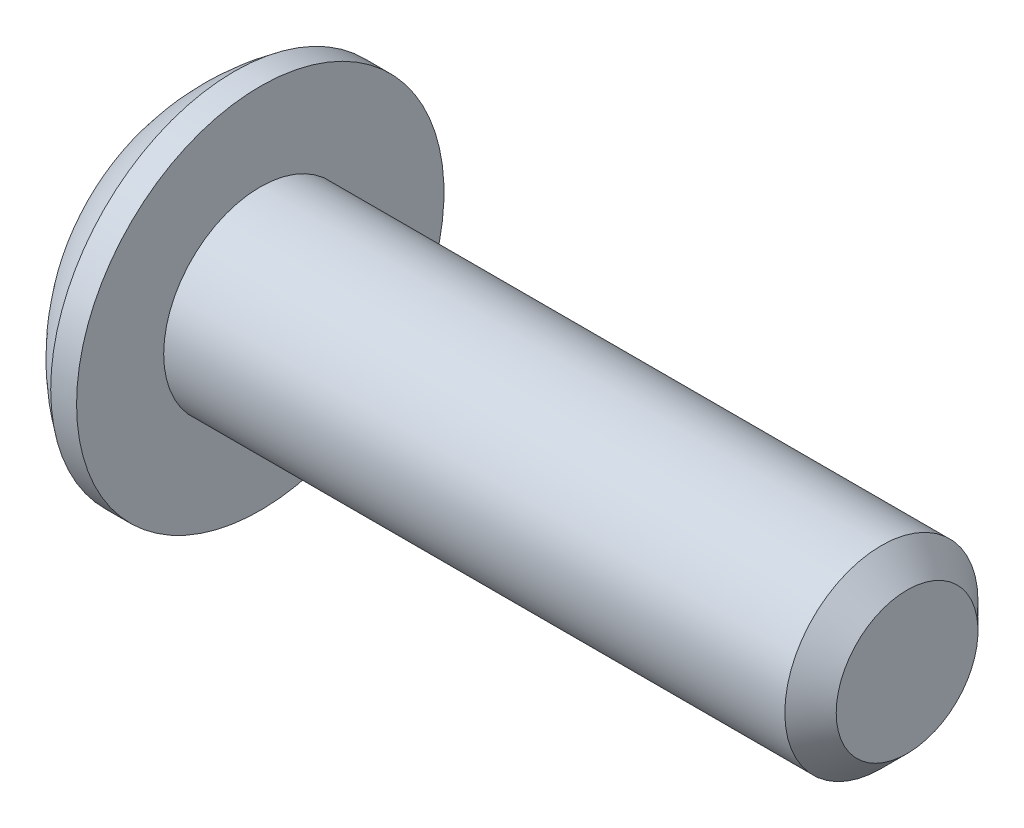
SolidWorks part; units mm, degrees
ref_plane "Plane1" through (0, 0, 0) normal (0, 0, 1) x (1, 0, 0)
ref_plane "Plane2" through (0, 0, 0) normal (0, 1, 0) x (1, 0, 0)
ref_plane "Plane3" through (0, 0, 0) normal (1, 0, 0) x (0, 0, -1)
sketch "BodySke" plane through (0, 0, 0) normal (0, 0, 1) x (1, 0, 0)
  line L0 (11.0236, 0) -> (11.0236, 1.0439)
  line L1 (10.6451, 1.4224) -> (1.4986, 1.4224)
  line L2 (1.4986, 1.4224) -> (1.4986, 2.7051)
  line L3 (1.4986, 2.7051) -> (1.1176, 2.7051)
  line L4 (0, 0) -> (101.6, 0) construction
  line L5 (1.4986, -2.7051) -> (1.1176, -2.7051) construction
  line L6 (55.6768, -1.4224) -> (1.4986, -1.4224) construction
  line L7 (11.0236, 0) -> (0, 0)
  line L8 (0, 1.3526) -> (0, -1.3526) construction
  line L9 (0, 0) -> (0, 1.3526)
  line L10 (11.0236, 1.0439) -> (10.6451, 1.4224)
  line L11 (11.0236, -1.0439) -> (10.6451, -1.4224) construction
  line L12 (2.1336, 9.525) -> (2.1336, -1.4224) construction
  line L13 (7.8486, 9.525) -> (7.8486, -1.4224) construction
  arc A1 (0, 1.3526) -> (1.1176, 2.7051) centre (3.0141, 0) cw
  dimension "D1" = 2.7051
  dimension "Diameter" = 2.8448
  dimension "Length" = 9.525
  dimension "Head_dia" = 5.4102
  dimension "Head_ht" = 1.4986
  dimension "Head_side_ht" = 0.381
  dimension "Minor_dia" = 2.0879
  dimension "Body_ch_ang" = 45
  dimension "Advance" = 0.635
  dimension "Thread_nom" = 3.175
revolve "BaseBody" add sketch "BodySke" angle 360 about L4
sketch "Sketch2" plane through (0, 0, 0) normal (0, 0, 1) x (1, 0, 0)
  line L0 (0, 0.7874) -> (0.889, 0.7874)
  line L1 (0.889, 0.7874) -> (1.3436, 0)
  line L3 (1.3436, 0) -> (0, 0)
  line L4 (0, 0) -> (0, 0.7874)
  line L5 (0, -0.7874) -> (0.889, -0.7874) construction
  line L6 (0, 0) -> (47.625, 0) construction
  dimension "D2" = 60
  dimension "PreBroach_depth" = 0.889
  dimension "PreBroach_dia" = 1.5748
revolve "PreBroach" cut sketch "Sketch2" angle 360 about L6
sketch "Sketch3" plane through (0, 0, 0) normal (1, 0, 0) x (0, 0, -1)
  line L0 (-0.7874, -0.4546) -> (-0.7874, 0.4546)
  line L1 (-0.7874, 0.4546) -> (0, 0.9092)
  line L2 (0, 0.9092) -> (0.7874, 0.4546)
  line L3 (0.7874, 0.4546) -> (0.7874, -0.4546)
  line L4 (0.7874, -0.4546) -> (0, -0.9092)
  line L5 (0, -0.9092) -> (-0.7874, -0.4546)
  dimension "D1" = 0.7874
  dimension "D2" = 0.7874
  dimension "D3" = 1.5748
  dimension "Hex_size" = 1.5748
extrude "Hex" cut sketch "Sketch3" along normal blind 0.889
sketch "Sketch4" plane through (0, 9.525, 0) normal (1, 0, 0) x (0, 0, -1)
  line L0 (0, -9.525) -> (0.9398, -9.525)
  line L1 (0, -9.525) -> (6.1484, -5.9752) construction
  line L2 (0, -9.525) -> (0.4699, -8.7111)
  line L3 (0.7832, -9.3075) -> (0.8962, -9.2422)
  line L4 (0.58, -8.9555) -> (0.693, -8.8902)
  arc A0 (0.7832, -9.3075) -> (0.58, -8.9555) centre (0, -9.525) ccw
  arc A1 (0.9398, -9.525) -> (0.8962, -9.2422) centre (0, -9.525) ccw
  arc A2 (0.4699, -8.7111) -> (0.693, -8.8902) centre (0, -9.525) cw
  dimension "D1" = 30
  dimension "Spline_n_dim" = 1.6256
  dimension "Spline_m_dim" = 1.8796
  dimension "D2" = 60
  dimension "D3" = 0.2032
  dimension "Spline_p_dim" = 0.4064
extrude "Spline" cut sketch "Sketch4" along normal blind 0.889
pattern_circular "CirPattern1" count 6 every 60 about axis through (0, 0, 0) along (1, 0, 0)
sketch "ThdSchSke" plane through (0, 0, 0) normal (0, 0, 1) x (1, 0, 0)
  line L0 (7.8486, -1.0439) -> (7.5836, -1.4224)
  line L1 (7.8486, -1.0439) -> (8.1136, -1.4224)
  line L2 (8.1136, -1.4224) -> (8.1136, -1.778)
  line L3 (-3.175, 0) -> (5.1513, 0) construction
  line L5 (8.1136, -1.778) -> (7.5836, -1.778)
  line L6 (7.5836, -1.778) -> (7.5836, -1.4224)
  dimension "Thread_minor" = 2.0879
  dimension "Diameter" = 2.8448
  dimension "Start" = 7.8486
  dimension "SideAngle" = 55
  dimension "VeeAngle" = 70
  dimension "Overcut" = 3.556
revolve "ThreadSchematic" cut sketch "ThdSchSke" angle 360 about L3
pattern_linear "ThdSchPat"
equation "\"D1@BodySke\" = \"Head_dia@BodySke\" * .5"
equation "\"Thread_minor@ThreadCosmetic\" = \"Minor_dia@BodySke\""
equation "\"D1@Sketch3\" = \"Hex_size@Sketch3\" / 2"
equation "\"D2@Sketch3\" = \"D1@Sketch3\""
equation "\"D3@Sketch3\" = \"Hex_size@Sketch3\""
equation "\"D3@Sketch4\" = \"Spline_p_dim@Sketch4\" / 2"
equation "\"D1@Sketch4\" = \"D2@Sketch4\" / 2"
equation "\"Thread_length@ThreadCosmetic\" = ((sgn( (\"Length@BodySke\" - \"Advance@BodySke\" ) - \"Thread_nom@BodySke\" )-1)*( (\"Length@BodySke\" - \"Advance@BodySke\" ) - \"Thread_nom@BodySke\" ))/-2+ \"Thread_nom@BodySke\""
equation "\"Thread_minor@ThdSchSke\" = \"Minor_dia@BodySke\""
equation "\"Diameter@ThdSchSke\" = \"Diameter@BodySke\""
equation "\"Overcut@ThdSchSke\" = \"Diameter@BodySke\" * 1.25"
equation "\"Start@ThdSchSke\" = \"Head_ht@BodySke\" + \"Length@BodySke\" - \"Thread_length@ThreadCosmetic\"  '---Non-countersunk---"
equation "\"Num_threads@ThdSchPat\" = int( \"Thread_length@ThreadCosmetic\" / \"Advance@BodySke\" + 0.999 )  + 1"
equation "\"Advance@ThdSchPat\" = \"Thread_length@ThreadCosmetic\" /  (\"Num_threads@ThdSchPat\" - 1) 'relax it"
equation "\"Num_threads@ThdSchPat\" = \"Num_threads@ThdSchPat\" - sgn( \"Num_threads@ThdSchPat\" - 1) '---chamfered tips only---"
